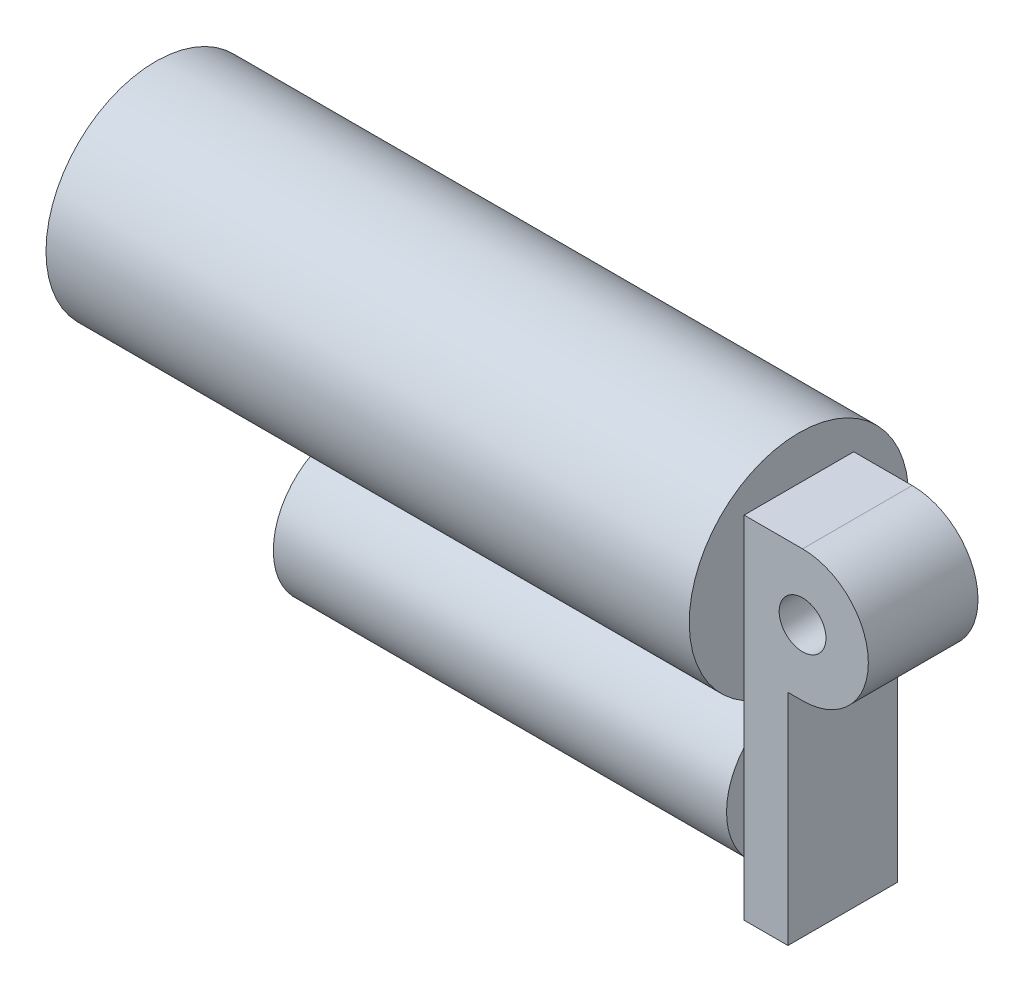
SolidWorks part; units mm, degrees
ref_plane "前视基准面" through (0, 0, 0) normal (0, 0, 1) x (1, 0, 0)
ref_plane "上视基准面" through (0, 0, 0) normal (0, 1, 0) x (1, 0, 0)
ref_plane "右视基准面" through (0, 0, 0) normal (1, 0, 0) x (0, 0, -1)
other "Configuration Table"
sketch "草图1" plane through (0, 0, 0) normal (0, 0, 1) x (1, 0, 0)
  line L0 (0, 4.5) -> (-4, 4.5)
  line L1 (-4, 4.5) -> (-4, -4.5)
  line L3 (0, -4.5) -> (-1, -4.5)
  line L5 (-4, -4.5) -> (-4, -19.5)
  line L6 (-4, -19.5) -> (-1, -19.5)
  line L7 (-1, -4.5) -> (-1, -19.5)
  arc A0 (0, 4.5) -> (0, -4.5) centre (0, 0) cw
  circle A1 centre (0, 0) radius 1.6
  point P10 (-4, -19.5)
  point P11 (-4, -4.5)
  point P12 (0, 0)
  dimension "D1" = 3.2
  dimension "D2" = 4.5
  dimension "D3" = 4
  dimension "D4" = 3
  dimension "D5" = 15
extrude "凸台-拉伸1" add sketch "草图1" along normal mid plane 7.5
sketch "草图2" plane through (-4, 0, 0) normal (-1, 0, 0) x (0, 0, 1)
  circle A0 centre (0, 0) radius 7.5
  circle A1 centre (0, -12.5) radius 4.95
  point P5 (0, 0)
  dimension "D1" = 15
  dimension "D2" = 9.9
  dimension "D3" = 12.5
extrude "凸台-拉伸3" add sketch "草图2" along normal blind 44
sketch "草图3" plane through (-48, 0, 0) normal (-1, 0, 0) x (0, 0, 1)
  circle A0 centre (0, -12.5) radius 4.95
extrude "切除-拉伸1" cut sketch "草图3" against normal blind 13
